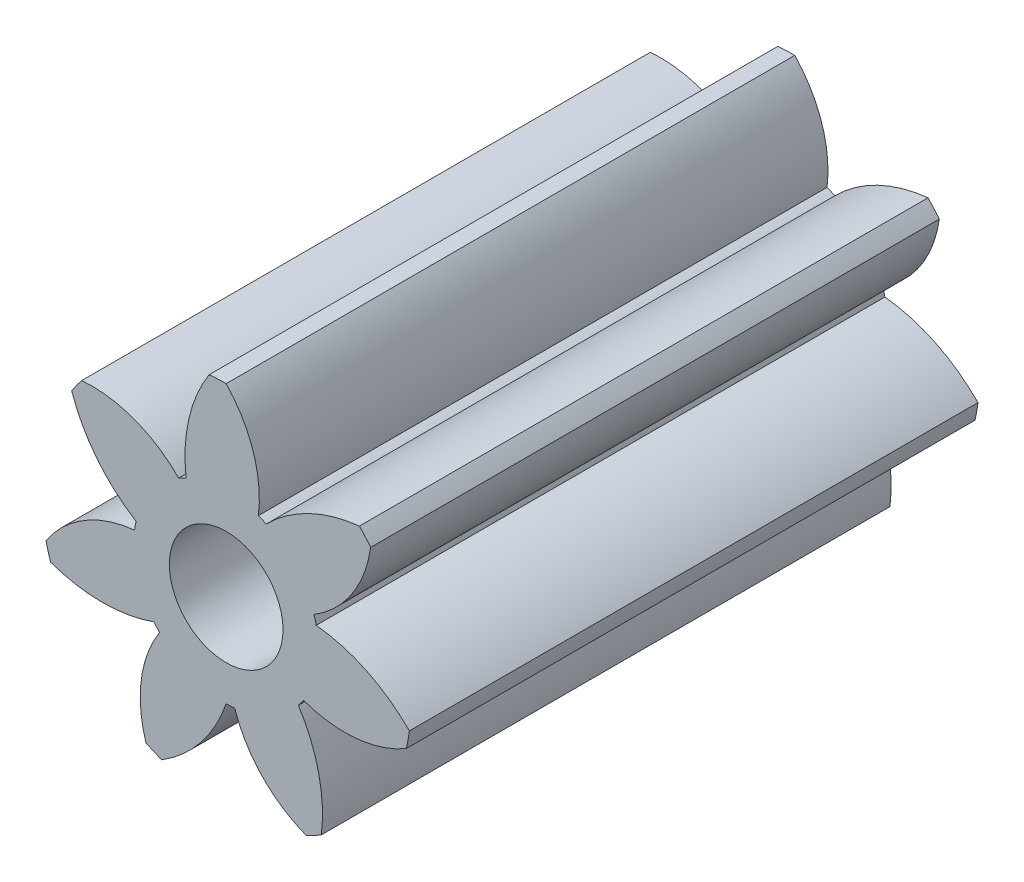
SolidWorks part; units mm, degrees
ref_plane "Face" through (0, 0, 0) normal (0, 0, 1) x (1, 0, 0)
ref_plane "Dessus" through (0, 0, 0) normal (0, 1, 0) x (1, 0, 0)
ref_plane "Droite" through (0, 0, 0) normal (1, 0, 0) x (0, 0, -1)
sketch "Esquisse1" plane through (0, 0, 0) normal (0, 0, 1) x (1, 0, 0)
  circle A0 centre (0, 0) radius 1.3
  circle A1 centre (0, 0) radius 0.4
  circle A2 centre (0, 0) radius 1.05 construction
  circle A3 centre (0, 0) radius 0.65 construction
  dimension "D1" = 2.6
  dimension "D2" = 0.8
  dimension "D3" = 2.1
  dimension "D4" = 1.3
extrude "Extrusion1" add sketch "Esquisse1" along normal blind 4
sketch "Esquisse3" plane through (0, 0, 4) normal (0, 0, 1) x (1, 0, 0)
  line L0 (0, 0) -> (0, 1.3) construction
  line L1 (0, 0) -> (-1.0164, 0.8105) construction
  line L2 (-0.3088, 0.572) -> (-0.6175, 1.144) construction
  line L3 (-0.282, 0.5856) -> (0, 0) construction
  circle A0 centre (0, 0) radius 1.3 construction
  arc A1 (0, 1.3) -> (-0.12, 1.2945) centre (0, 0) ccw construction
  arc A2 (-0.12, 1.2945) -> (-0.282, 0.5856) centre (0.7886, 0.7138) ccw
  circle A3 centre (0, 0) radius 0.65 construction
  arc A4 (-0.282, 0.5856) -> (-0.3349, 0.5571) centre (0, 0) ccw
  arc A5 (-0.3349, 0.5571) -> (-1.0164, 0.8105) centre (-0.9437, -0.0371) ccw
  arc A6 (-1.0164, 0.8105) -> (-0.12, 1.2945) centre (0, 0) cw
  circle A7 centre (0, 0) radius 1.3 construction
  dimension "D1" = 51.429
  dimension "D2" = 25.714
extrude "Extrusion3" cut sketch "Esquisse3" against normal through all contours A2 A4 A5 A6
pattern_circular "Répétition circulaire2" count 7 over 360 about axis through (0, 0, 0) along (0, 0, 1) of "Extrusion3"
